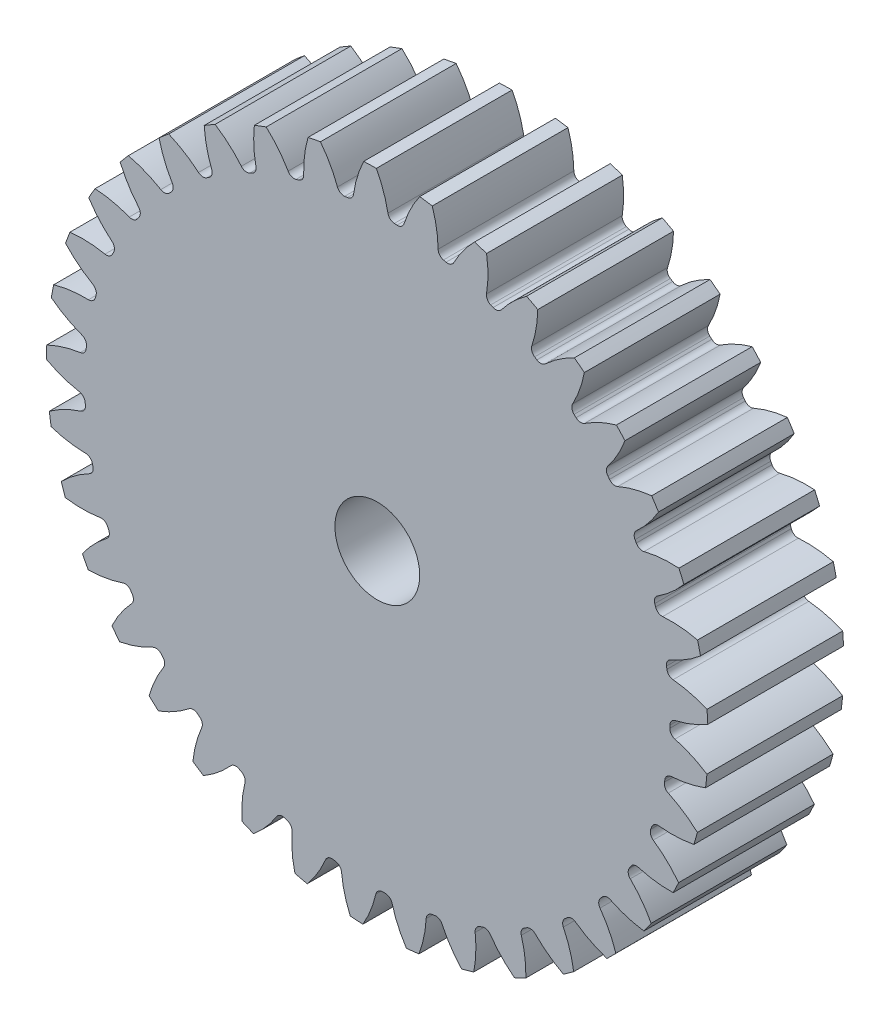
SolidWorks part; units mm, degrees
ref_plane "Front" through (0, 0, 0) normal (0, 0, 1) x (1, 0, 0)
ref_plane "Top" through (0, 0, 0) normal (0, 1, 0) x (1, 0, 0)
ref_plane "Right" through (0, 0, 0) normal (1, 0, 0) x (0, 0, -1)
sketch "Sketch3" plane through (0, 0, 0) normal (0, 0, 1) x (1, 0, 0)
  circle A0 centre (0, 0) radius 247.65
  dimension "od" = 495.3
extrude "gearBody" add sketch "Sketch3" along normal blind 101.6
sketch "Sketch2" plane through (0, 0, 0) normal (0, 0, 1) x (1, 0, 0)
  line L0 (0, 0) -> (203.9748, 84.4891) construction
  line L1 (246.9814, -21.4644) -> (0, 0) construction
  line L2 (0, 0) -> (36.3143, 0) construction
  line L3 (234.8933, 5.1596) -> (234.4892, -14.7076) construction
  line L5 (234.6913, -4.774) -> (0, 0) construction
  line L7 (0, 0) -> (220.7808, 0) construction
  arc A0 (220.7784, 1.0219) -> (220.5542, -9.9994) centre (0, 0) ccw construction
  arc A1 (247.3943, 11.2506) -> (246.7321, -21.302) centre (0, 0) ccw construction
  arc A2 (234.8933, 5.1596) -> (234.4892, -14.7076) centre (0, 0) ccw construction
  arc A3 (219.0068, -5.468) -> (219.0479, -3.4428) centre (0, 0) ccw
  arc A4 (246.9814, -21.4644) -> (222.8116, -10.5831) centre (200.3702, -92.7142) ccw
  arc A5 (246.9814, -21.4644) -> (247.65, 11.4028) centre (0, 0) ccw
  arc A6 (247.65, 11.4028) -> (223.0577, 1.5134) centre (203.9748, 84.4891) cw
  arc A7 (219.0479, -3.4428) -> (223.0577, 1.5134) centre (224.2162, -3.524) cw
  arc A8 (222.8116, -10.5831) -> (219.0068, -5.468) centre (224.174, -5.597) cw
  point P6 (247.65, 11.4028)
  point P22 (246.9814, -21.4644)
  dimension "baseDia" = 441.5616
  dimension "od" = 495.3
  dimension "pd" = 469.9
  dimension "rd" = 438.15
  dimension "rFillet" = 5.1689
  dimension "pointX" = 247.65
  dimension "pointY" = 11.4028
  dimension "CTT" = 19.8672
  dimension "flankCenterAngle" = 22.5
extrude "toothCut" cut sketch "Sketch2" along normal through all
pattern_circular "CirPattern1" count 37 over 360 about axis through (0, 0, 0) along (0, 0, 1) of "toothCut"
sketch "hub1Dia" plane through (0, 0, 0) normal (0, 0, -1) x (-1, 0, 0)
  circle A0 centre (0, 0) radius 12.7
  dimension "hub1Dia" = 25.4
sketch "hub2Dia" plane through (0, 0, 101.6) normal (0, 0, 1) x (1, 0, 0)
  circle A0 centre (0, 0) radius 12.7
  dimension "hub2dia" = 25.4
sketch "boreDia" plane through (0, 0, 0) normal (0, 0, 1) x (1, 0, 0)
  circle A0 centre (0, 0) radius 31.75
  dimension "boreDia" = 63.5
extrude "bore" cut sketch "boreDia" against normal mid plane 25400
